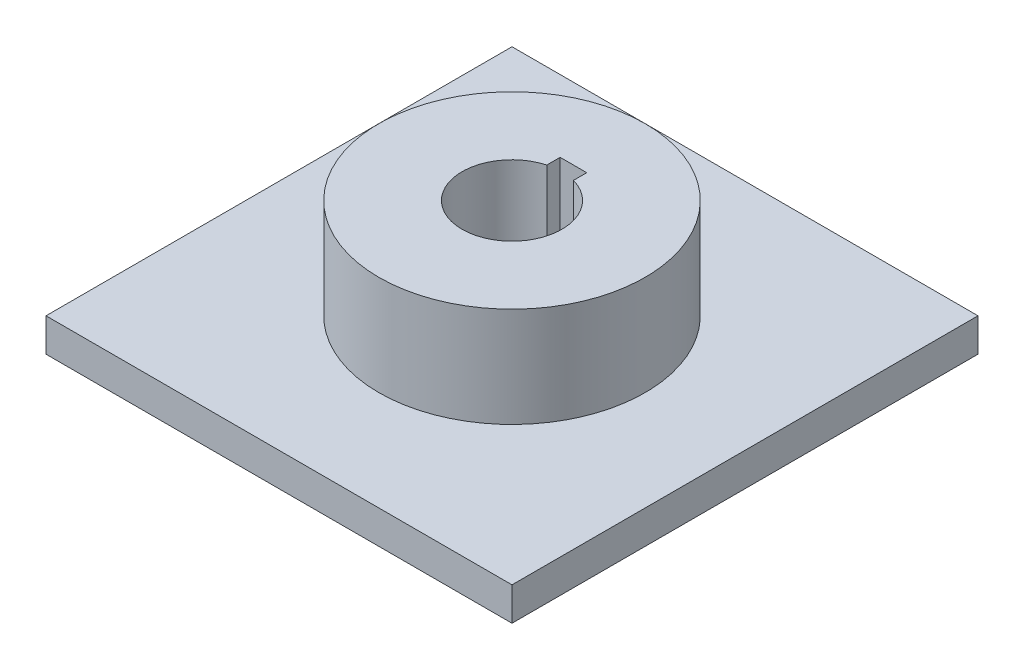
SolidWorks part; units mm, degrees
ref_plane "Front Plane" through (0, 0, 0) normal (0, 0, 1) x (1, 0, 0)
ref_plane "Top Plane" through (0, 0, 0) normal (0, 1, 0) x (1, 0, 0)
ref_plane "Right Plane" through (0, 0, 0) normal (1, 0, 0) x (0, 0, -1)
sketch "Sketch9" plane through (0, 0, 0) normal (0, 1, 0) x (1, 0, 0)
  line L1 (-35, 35) -> (35, 35)
  line L2 (-35, 35) -> (-35, -35)
  line L3 (-35, -35) -> (35, -35)
  line L4 (35, 35) -> (35, -35)
  line L5 (-35, 35) -> (35, -35) construction
  line L6 (-35, -35) -> (35, 35) construction
  point P0 (0, 0)
extrude "Boss-Extrude5" add sketch "Sketch9" along normal blind 5
sketch "Sketch10" plane through (0, 5, 0) normal (0, 1, 0) x (1, 0, 0)
  line L0 (0, 0) -> (0, 5.7291) construction
  line L1 (-2, 7.2284) -> (-2, 9.2284)
  line L2 (-2, 9.2284) -> (2, 9.2284)
  line L3 (2, 9.2284) -> (2, 7.2284)
  arc A0 (-2, 7.2284) -> (2, 7.2284) centre (0, 0) ccw
  circle A1 centre (0, 0) radius 20
  point P6 (0, 9.2284)
  dimension "D1" = 15
  dimension "D4" = 40
  dimension "D2" = 2
  dimension "D3" = 4
extrude "Boss-Extrude6" add sketch "Sketch10" along normal blind 15
